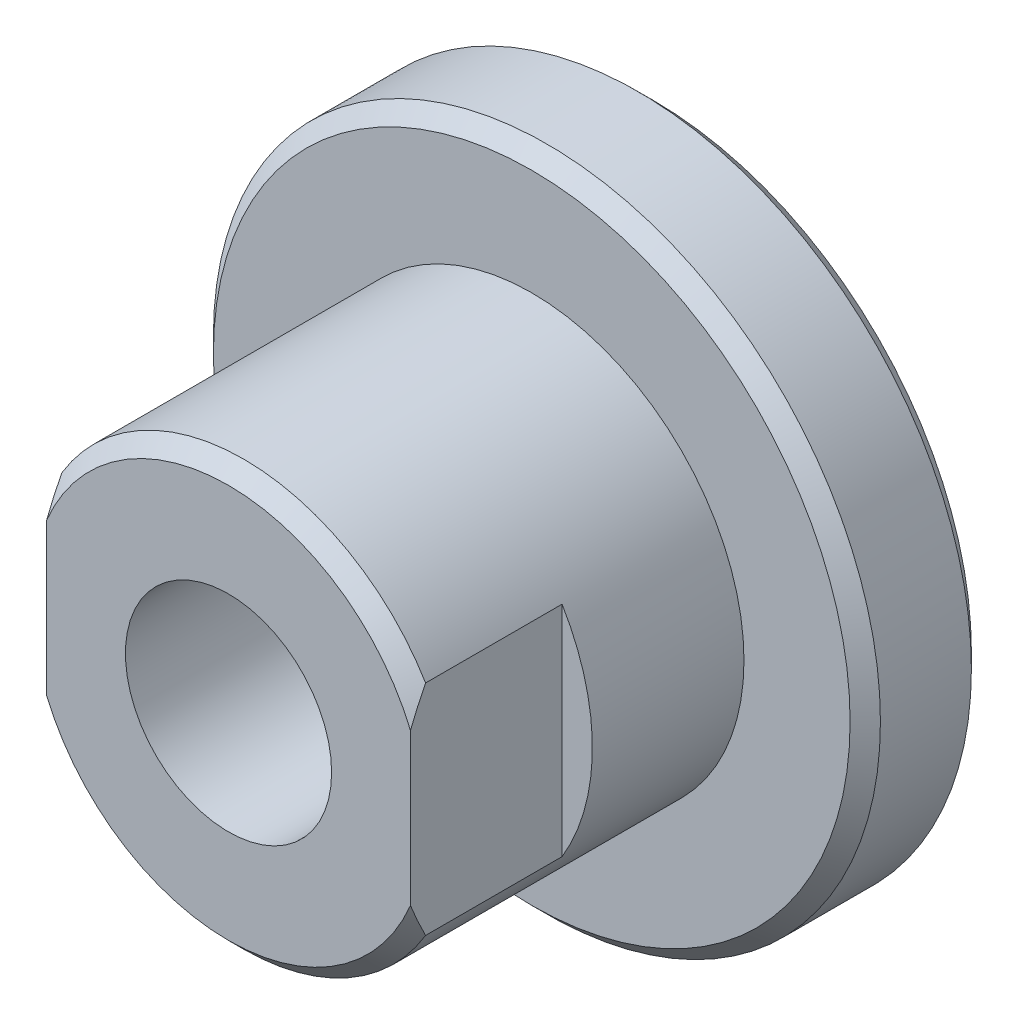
SolidWorks part; units mm, degrees
ref_plane "Face" through (0, 0, 0) normal (0, 0, 1) x (1, 0, 0)
ref_plane "Dessus" through (0, 0, 0) normal (0, 1, 0) x (1, 0, 0)
ref_plane "Droite" through (0, 0, 0) normal (1, 0, 0) x (0, 0, -1)
sketch "Esquisse1" plane through (0, 0, 0) normal (0, 0, 1) x (1, 0, 0)
  circle A0 centre (0, 0) radius 11
  dimension "D1" = 22
extrude "Extrusion1" add sketch "Esquisse1" along normal blind 4
sketch "Esquisse2" plane through (0, 0, 4) normal (0, 0, 1) x (1, 0, 0)
  circle A0 centre (0, 0) radius 7
  dimension "D1" = 14
extrude "Extrusion2" add sketch "Esquisse2" along normal blind 10
chamfer "Chanfrein2" distance 0.5 angle 45 3 edges at (7, 0, 14) (11, 0, 0) (11, 0, 4)
sketch "Esquisse3" plane through (0, 0, 14) normal (0, 0, 1) x (1, 0, 0)
  line L1 (6, 11.2334) -> (14.7084, 11.2334)
  line L2 (6, 11.2334) -> (6, -10.615)
  line L3 (6, -10.615) -> (14.7084, -10.615)
  line L4 (14.7084, 11.2334) -> (14.7084, -10.615)
  line L5 (-6, 13.8098) -> (-13.4717, 13.8098)
  line L6 (-6, 13.8098) -> (-6, -10.615)
  line L7 (-6, -10.615) -> (-13.4717, -10.615)
  line L8 (-13.4717, 13.8098) -> (-13.4717, -10.615)
  dimension "D1" = 12
  dimension "D2" = 6
extrude "Enlèv. mat.-Extru.1" cut sketch "Esquisse3" against normal blind 5
hole_wizard "Trou taraudé M81" positions "Esquisse5" profile "Esquisse4" tap size "M8" standard "ISO"
sketch "Esquisse5" plane through (0, 0, 14) normal (0, 0, 1) x (1, 0, 0)
  arc A0 (6, 2.5) -> (-6, 2.5) centre (0, 0) ccw construction
  point P0 (0, 0)
sketch "Esquisse4" plane through (0, 0, 14) normal (1, 0, 0) x (0, -1, 0)
  line L0 (0, 0) -> (0, 14)
  line L1 (0, 14) -> (3.4, 14)
  line L2 (3.4, 14) -> (3.4, 0)
  line L5 (3.4, 0) -> (0, 0)
  line L11 (0, -6.35) -> (0, 107.95) construction
  dimension "Diamètre du trou pour taraudage jusqu'au prochain" = 6.8
  dimension "Profondeur du trou pour taraudage jusqu'au prochain" = 14
